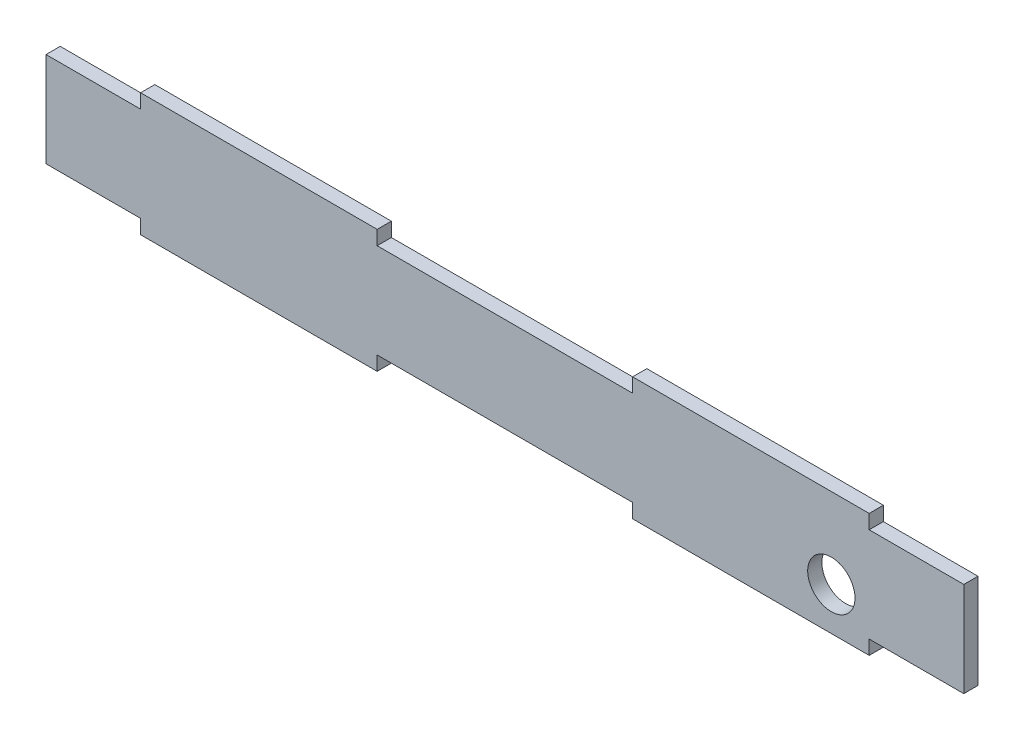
SolidWorks part; units mm, degrees
ref_plane "Front Plane" through (0, 0, 0) normal (0, 0, 1) x (1, 0, 0)
ref_plane "Top Plane" through (0, 0, 0) normal (0, 1, 0) x (1, 0, 0)
ref_plane "Right Plane" through (0, 0, 0) normal (1, 0, 0) x (0, 0, -1)
sketch "Sketch1" plane through (0, 0, 0) normal (0, 0, 1) x (1, 0, 0)
  line L0 (0, 20) -> (20, 20) construction
  line L1 (0, 0) -> (194, 0)
  line L2 (0, 0) -> (0, 20)
  line L3 (0, 20) -> (194, 20)
  line L4 (194, 0) -> (194, 20)
  line L5 (97, 20) -> (97, 0) construction
  line L6 (20, 20) -> (70, 20)
  line L7 (20, 20) -> (20, 23)
  line L8 (20, 23) -> (70, 23)
  line L9 (70, 20) -> (70, 23)
  line L10 (0, 10) -> (194, 10) construction
  line L11 (124, 20) -> (124, 23)
  line L12 (174, 23) -> (124, 23)
  line L13 (174, 20) -> (174, 23)
  line L14 (174, 20) -> (124, 20)
  line L15 (174, 0) -> (124, 0)
  line L16 (174, 0) -> (174, -3)
  line L17 (174, -3) -> (124, -3)
  line L18 (124, 0) -> (124, -3)
  line L19 (70, 0) -> (70, -3)
  line L20 (20, -3) -> (70, -3)
  line L21 (20, 0) -> (20, -3)
  line L22 (20, 0) -> (70, 0)
  line L23 (194, 10) -> (164, 10) construction
  line L24 (164, 0) -> (164, 6) construction
  circle A1 centre (166, 6) radius 5
  dimension "D1" = 20
  dimension "D2" = 194
  dimension "D3" = 20
  dimension "D4" = 3
  dimension "D5" = 50
  dimension "D6" = 30
  dimension "D7" = 6
extrude "Boss-Extrude1" add sketch "Sketch1" along normal blind 3
